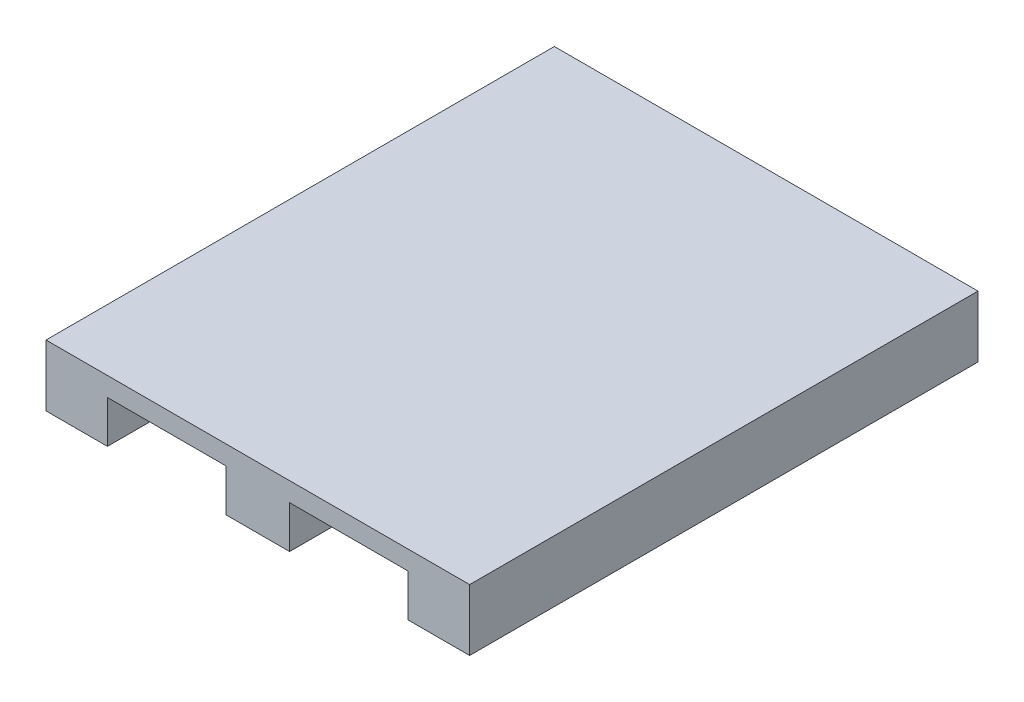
SolidWorks part; units mm, degrees
ref_plane "Ebene vorne" through (0, 0, 0) normal (0, 0, 1) x (1, 0, 0)
ref_plane "Ebene oben" through (0, 0, 0) normal (0, 1, 0) x (1, 0, 0)
ref_plane "Ebene rechts" through (0, 0, 0) normal (1, 0, 0) x (0, 0, -1)
sketch "Skizze1" plane through (0, 0, 0) normal (0, 0, 1) x (1, 0, 0)
  line L0 (-355, 0) -> (-355, 100)
  line L1 (-500, 0) -> (-355, 0)
  line L2 (-500, 0) -> (-500, 145)
  line L3 (-500, 145) -> (500, 145)
  line L4 (500, 0) -> (500, 145)
  line L5 (-355, 100) -> (-75, 100)
  line L6 (-75, 100) -> (-75, 0)
  line L7 (-75, 0) -> (75, 0)
  line L8 (355, 0) -> (355, 100)
  line L9 (355, 100) -> (75, 100)
  line L10 (0, 0) -> (0, 145) construction
  line L11 (75, 100) -> (75, 0)
  line L12 (355, 0) -> (500, 0)
  dimension "D1" = 1000
  dimension "D2" = 145
  dimension "D3" = 145
  dimension "D4" = 280
  dimension "D5" = 100
extrude "Linear austragen1" add sketch "Skizze1" against normal blind 1200
fillet "Verrundung2" [suppressed] radius 10
fillet "Verrundung4" [suppressed] radius 10
fillet "Verrundung1" [suppressed] radius 30
sketch "Skizze2" [suppressed] plane through (0, 0, 0) normal (1, 0, 0) x (0, 0, -1)
  line L0 (600, 0) -> (600, 145) construction
  line L1 (1170, 0) -> (30, 0) construction
  line L2 (1170, 145) -> (30, 145) construction
  line L3 (261.6553, 122.5) -> (458.3447, 122.5)
  line L4 (461.6327, 122.2279) -> (503.288, 115.2853)
  line L5 (520, 95.5575) -> (520, 49.4425)
  line L6 (503.288, 29.7147) -> (461.6327, 22.7721)
  line L7 (458.3447, 22.5) -> (261.6553, 22.5)
  line L8 (258.3673, 22.7721) -> (216.712, 29.7147)
  line L9 (200, 49.4425) -> (200, 95.5575)
  line L10 (216.712, 115.2853) -> (258.3673, 122.2279)
  line L11 (360, 22.5) -> (360, 122.5) construction
  line L13 (200, 72.5) -> (520, 72.5) construction
  line L14 (0, 0) -> (0, 145) construction
  line L15 (938.3447, 122.5) -> (741.6553, 122.5)
  line L16 (983.288, 115.2853) -> (941.6327, 122.2279)
  line L17 (1000, 49.4425) -> (1000, 95.5575)
  line L18 (941.6327, 22.7721) -> (983.288, 29.7147)
  line L19 (741.6553, 22.5) -> (938.3447, 22.5)
  line L20 (696.712, 29.7147) -> (738.3673, 22.7721)
  line L21 (680, 95.5575) -> (680, 49.4425)
  line L22 (738.3673, 122.2279) -> (696.712, 115.2853)
  arc A0 (200, 95.5575) -> (216.712, 115.2853) centre (220, 95.5575) cw
  arc A1 (261.6553, 122.5) -> (258.3673, 122.2279) centre (261.6553, 102.5) ccw
  arc A2 (216.712, 29.7147) -> (200, 49.4425) centre (220, 49.4425) cw
  arc A3 (261.6553, 22.5) -> (258.3673, 22.7721) centre (261.6553, 42.5) cw
  arc A4 (461.6327, 22.7721) -> (458.3447, 22.5) centre (458.3447, 42.5) cw
  arc A5 (520, 49.4425) -> (503.288, 29.7147) centre (500, 49.4425) cw
  arc A6 (503.288, 115.2853) -> (520, 95.5575) centre (500, 95.5575) cw
  arc A7 (458.3447, 122.5) -> (461.6327, 122.2279) centre (458.3447, 102.5) cw
  arc A8 (741.6553, 122.5) -> (738.3673, 122.2279) centre (741.6553, 102.5) ccw
  arc A9 (938.3447, 122.5) -> (941.6327, 122.2279) centre (938.3447, 102.5) cw
  arc A10 (1000, 95.5575) -> (983.288, 115.2853) centre (980, 95.5575) ccw
  arc A11 (983.288, 29.7147) -> (1000, 49.4425) centre (980, 49.4425) ccw
  arc A12 (938.3447, 22.5) -> (941.6327, 22.7721) centre (938.3447, 42.5) ccw
  arc A13 (738.3673, 22.7721) -> (741.6553, 22.5) centre (741.6553, 42.5) ccw
  arc A14 (680, 49.4425) -> (696.712, 29.7147) centre (700, 49.4425) ccw
  arc A15 (696.712, 115.2853) -> (680, 95.5575) centre (700, 95.5575) ccw
  point P25 (200, 112.5)
  point P30 (200, 32.5)
  point P33 (260, 22.5)
  point P36 (460, 22.5)
  dimension "D7" = 20
  dimension "D1" = 100
  dimension "D2" = 200
  dimension "D3" = 22.5
  dimension "D4" = 320
  dimension "D5" = 80
  dimension "D6" = 200
extrude "Schnitt-Linear austragen1" [suppressed] cut sketch "Skizze2" against normal through all and the other way through all
fillet "Verrundung5" [suppressed] radius 10
sketch "Skizze3" [suppressed] plane through (0, 145, 0) normal (0, 1, 0) x (1, 0, 0)
  line L0 (0, 0) -> (0, 1200) construction
  line L1 (470, 0) -> (385, 0)
  line L2 (470, 0) -> (470, 3)
  line L3 (470, 3) -> (385, 3)
  line L4 (385, 0) -> (385, 3)
  line L5 (500, 30) -> (497, 30)
  line L6 (500, 30) -> (500, 115)
  line L7 (500, 115) -> (497, 115)
  line L8 (497, 30) -> (497, 115)
  line L9 (470, 1200) -> (-470, 1200) construction
  line L10 (500, 600) -> (-500, 600) construction
  line L11 (500, 1170) -> (500, 30) construction
  line L12 (-500, 1170) -> (-500, 30) construction
  line L13 (-497, 30) -> (-497, 115)
  line L14 (-500, 115) -> (-497, 115)
  line L15 (-500, 30) -> (-500, 115)
  line L16 (-500, 30) -> (-497, 30)
  line L17 (-385, 0) -> (-385, 3)
  line L18 (-470, 3) -> (-385, 3)
  line L19 (-470, 0) -> (-470, 3)
  line L20 (-470, 0) -> (-385, 0)
  line L21 (497, 1170) -> (497, 1085)
  line L22 (500, 1085) -> (497, 1085)
  line L23 (500, 1170) -> (500, 1085)
  line L24 (500, 1170) -> (497, 1170)
  line L25 (385, 1200) -> (385, 1197)
  line L26 (470, 1197) -> (385, 1197)
  line L27 (470, 1200) -> (470, 1197)
  line L28 (470, 1200) -> (385, 1200)
  line L29 (-470, 1200) -> (-385, 1200)
  line L30 (-470, 1200) -> (-470, 1197)
  line L31 (-470, 1197) -> (-385, 1197)
  line L32 (-385, 1200) -> (-385, 1197)
  line L33 (-500, 1170) -> (-497, 1170)
  line L34 (-500, 1170) -> (-500, 1085)
  line L35 (-500, 1085) -> (-497, 1085)
  line L36 (-497, 1170) -> (-497, 1085)
  line L37 (-497, 557.5) -> (-497, 642.5)
  line L38 (500, 557.5) -> (497, 557.5)
  line L39 (500, 557.5) -> (500, 642.5)
  line L40 (500, 642.5) -> (497, 642.5)
  line L41 (497, 557.5) -> (497, 642.5)
  line L42 (-500, 642.5) -> (-497, 642.5)
  line L43 (-500, 557.5) -> (-500, 642.5)
  line L44 (-500, 557.5) -> (-497, 557.5)
  dimension "D1" = 3
extrude "Linear austragen2" [suppressed] add sketch "Skizze3" along normal blind 8
sketch "Skizze4" plane through (0, 0, 0) normal (0, 0, 1) x (1, 0, 0)
  line L1 (500, 145) -> (-500, 145) construction
  line L3 (-59.7913, 165) -> (59.7913, 165)
  arc A0 (-59.7913, 165) -> (59.7913, 165) centre (0, 160) ccw
  dimension "D1" = 60
  dimension "D2" = 15
  dimension "D3" = 20
extrude "Schnitt-Linear austragen2" [suppressed] cut sketch "Skizze4" against normal blind 130 draft 5
fillet "Verrundung6" [suppressed] radius 10
